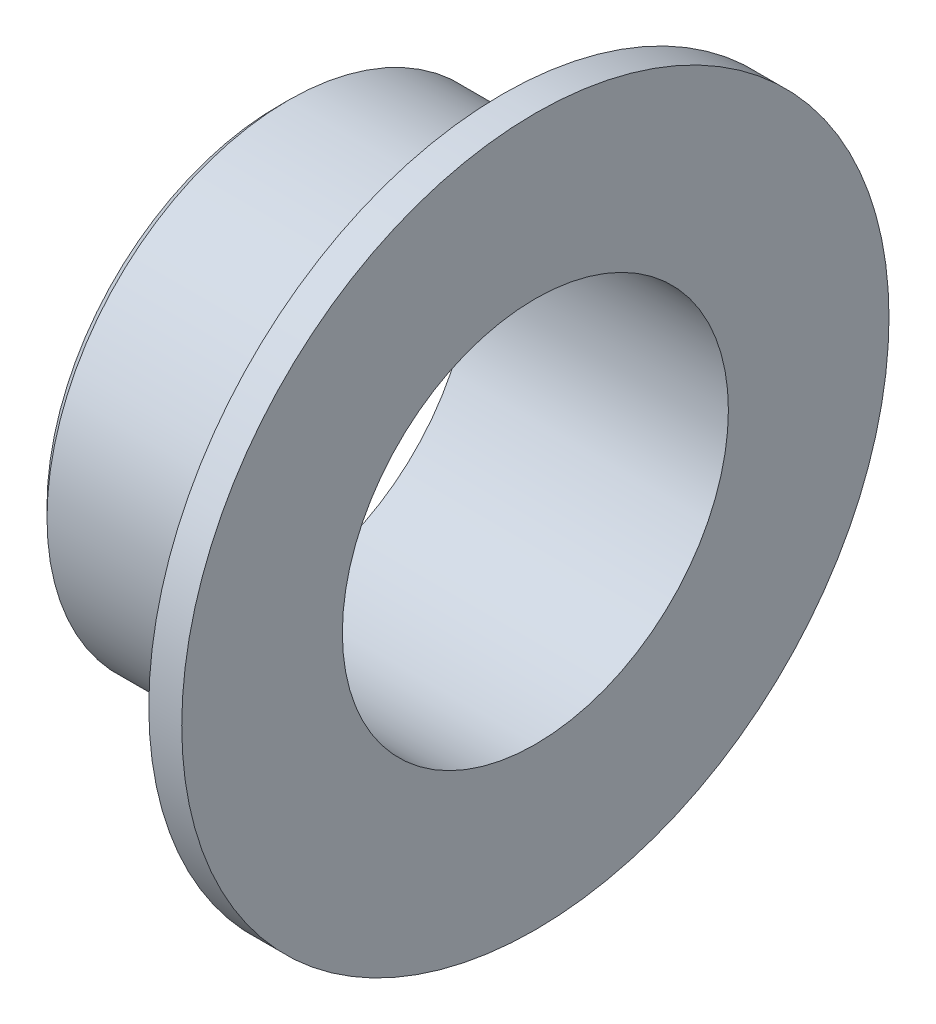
SolidWorks part; units mm, degrees
ref_plane "Plane1" through (0, 0, 0) normal (0, 0, 1) x (1, 0, 0)
ref_plane "Plane2" through (0, 0, 0) normal (0, 1, 0) x (1, 0, 0)
ref_plane "Plane3" through (0, 0, 0) normal (1, 0, 0) x (0, 0, -1)
sketch "Sketch1" plane through (0, 0, 0) normal (0, 0, 1) x (1, 0, 0)
  line L1 (0, -4.7625) -> (6.35, -4.7625)
  line L5 (0, 0) -> (24.8996, 0) construction
  line L7 (0, -5.9531) -> (5.5372, -5.9531)
  line L9 (5.5372, -8.7249) -> (6.35, -8.7249)
  line L11 (6.35, -4.7625) -> (6.35, -8.7249)
  line L13 (0, -5.9531) -> (0, -4.7625)
  line L15 (5.5372, -8.7249) -> (5.5372, -5.9531)
  dimension "D1" = 5.9531
  dimension "D3" = 0.8128
  dimension "D2" = 8.7249
  dimension "D4" = 4.7625
  dimension "D5" = 6.35
revolve "Base-Revolve" add sketch "Sketch1" angle 360 about L5
chamfer "Chamfer1" distance 0.254 angle 45
